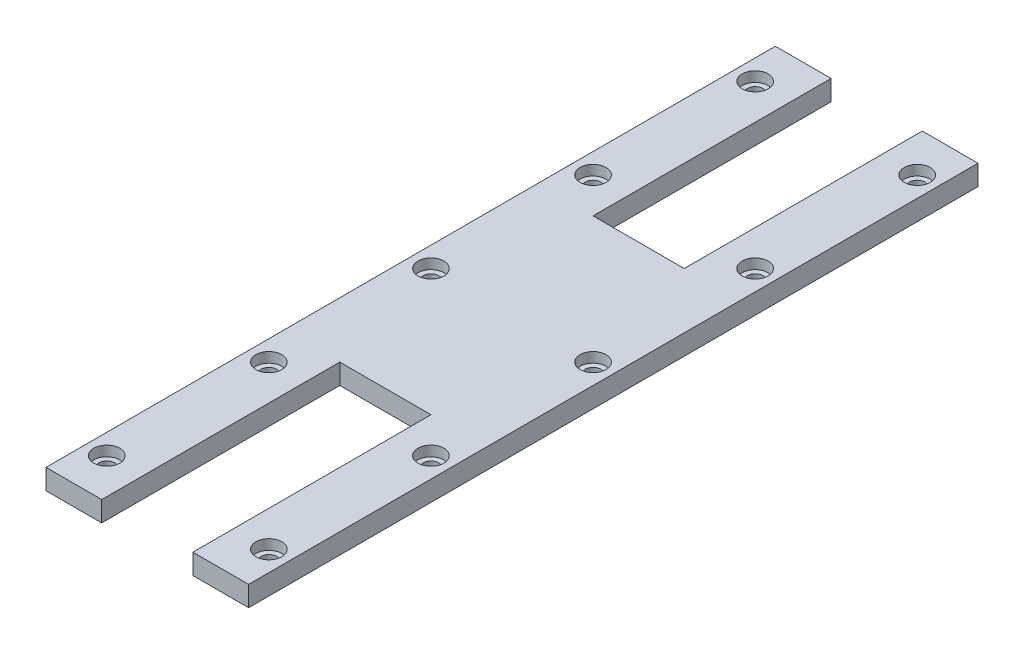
SolidWorks part; units mm, degrees
ref_plane "Front Plane" through (0, 0, 0) normal (0, 0, 1) x (1, 0, 0)
ref_plane "Top Plane" through (0, 0, 0) normal (0, 1, 0) x (1, 0, 0)
ref_plane "Right Plane" through (0, 0, 0) normal (1, 0, 0) x (0, 0, -1)
sketch "Sketch1" plane through (0, 0, 0) normal (0, 0, 1) x (1, 0, 0)
  line L1 (0, 0) -> (63.5, 0)
  line L2 (0, 0) -> (0, 6.35)
  line L3 (0, 6.35) -> (63.5, 6.35)
  line L4 (63.5, 0) -> (63.5, 6.35)
  dimension "D1" = 63.5
  dimension "D2" = 6.35
extrude "Boss-Extrude1" add sketch "Sketch1" against normal blind 228.6
sketch "Sketch2" plane through (0, 6.35, 0) normal (0, 1, 0) x (1, 0, 0)
  line L0 (63.5, 228.6) -> (0, 228.6) construction
  line L1 (17.4625, 228.6) -> (46.0375, 228.6)
  line L2 (17.4625, 228.6) -> (17.4625, 153.9875)
  line L3 (17.4625, 153.9875) -> (46.0375, 153.9875)
  line L4 (46.0375, 228.6) -> (46.0375, 153.9875)
  line L5 (63.5, 0) -> (0, 0) construction
  line L6 (17.4625, 0) -> (46.0375, 0)
  line L7 (17.4625, 0) -> (17.4625, 74.6125)
  line L8 (17.4625, 74.6125) -> (46.0375, 74.6125)
  line L9 (46.0375, 0) -> (46.0375, 74.6125)
  line L10 (0, 228.6) -> (0, 0) construction
  dimension "D1" = 28.575
  dimension "D2" = 28.575
  dimension "D3" = 74.6125
  dimension "D4" = 74.6125
  dimension "D5" = 17.4625
  dimension "D6" = 17.4625
extrude "Cut-Extrude1" cut sketch "Sketch2" against normal blind 127
sketch "Sketch3" plane through (0, 6.35, 0) normal (0, 1, 0) x (1, 0, 0)
  line L0 (17.4625, 228.6) -> (0, 228.6) construction
  line L1 (17.4625, 0) -> (0, 0) construction
  line L2 (0, 228.6) -> (0, 0) construction
  line L3 (63.5, 228.6) -> (63.5, 0) construction
  line L4 (63.5, 228.6) -> (46.0375, 228.6) construction
  line L6 (63.5, 0) -> (46.0375, 0) construction
  circle A0 centre (6.35, 215.9) radius 2.4574
  circle A2 centre (6.35, 165.1) radius 2.4574
  circle A3 centre (6.35, 114.3) radius 2.4575
  circle A5 centre (57.15, 165.1) radius 2.4574
  circle A6 centre (57.15, 114.3) radius 2.4574
  circle A7 centre (57.15, 63.5) radius 2.4574
  circle A8 centre (6.35, 63.5) radius 2.4574
  circle A9 centre (57.15, 215.9) radius 2.4574
  circle A10 centre (6.35, 12.7) radius 2.4574
  circle A11 centre (57.15, 12.7) radius 2.4574
  point P12 (0, 0)
  point P13 (0, 0)
  dimension "D1" = 12.7
  dimension "D3" = 6.35
  dimension "D4" = 50.8
  dimension "D5" = 4.9149
  dimension "D7" = 4.9149
  dimension "D8" = 4.9149
  dimension "D9" = 6.35
  dimension "D11" = 4.9149
  dimension "D12" = 4.9149
  dimension "D13" = 4.9149
  dimension "D14" = 4.9149
  dimension "D20" = 4.9149
  dimension "D21" = 6.35
  dimension "D22" = 6.35
  dimension "D25" = 50.8
  dimension "D26" = 4.9149
  dimension "D27" = 4.9149
  dimension "D30" = 12.7
  dimension "D31" = 50.8
  dimension "D32" = 50.8
  dimension "D15" = 50.8
  dimension "D17" = 6.35
  dimension "D18" = 6.35
  dimension "D19" = 6.35
  dimension "D23" = 50.8
  dimension "D24" = 12.7
  dimension "D28" = 6.35
  dimension "D29" = 12.7
extrude "Cut-Extrude2" cut sketch "Sketch3" against normal blind 6.35
sketch "Sketch4" plane through (0, 6.35, 0) normal (0, 1, 0) x (1, 0, 0)
  circle A0 centre (6.35, 215.9) radius 4.064
  circle A1 centre (6.35, 63.5) radius 4.064
  circle A2 centre (6.35, 165.1) radius 4.064
  circle A3 centre (6.35, 114.3) radius 4.064
  circle A4 centre (57.15, 63.5) radius 4.064
  circle A5 centre (57.15, 114.3) radius 4.064
  circle A6 centre (57.15, 165.1) radius 4.064
  circle A7 centre (57.15, 12.7) radius 4.064
  circle A8 centre (57.15, 215.9) radius 4.064
  circle A9 centre (6.35, 12.7) radius 4.064
  dimension "D1" = 8.128
  dimension "D2" = 8.128
  dimension "D3" = 8.128
  dimension "D4" = 8.128
  dimension "D5" = 8.128
  dimension "D6" = 8.128
  dimension "D7" = 8.128
  dimension "D8" = 8.128
  dimension "D9" = 8.128
  dimension "D10" = 8.128
extrude "Cut-Extrude3" cut sketch "Sketch4" against normal blind 3.175
